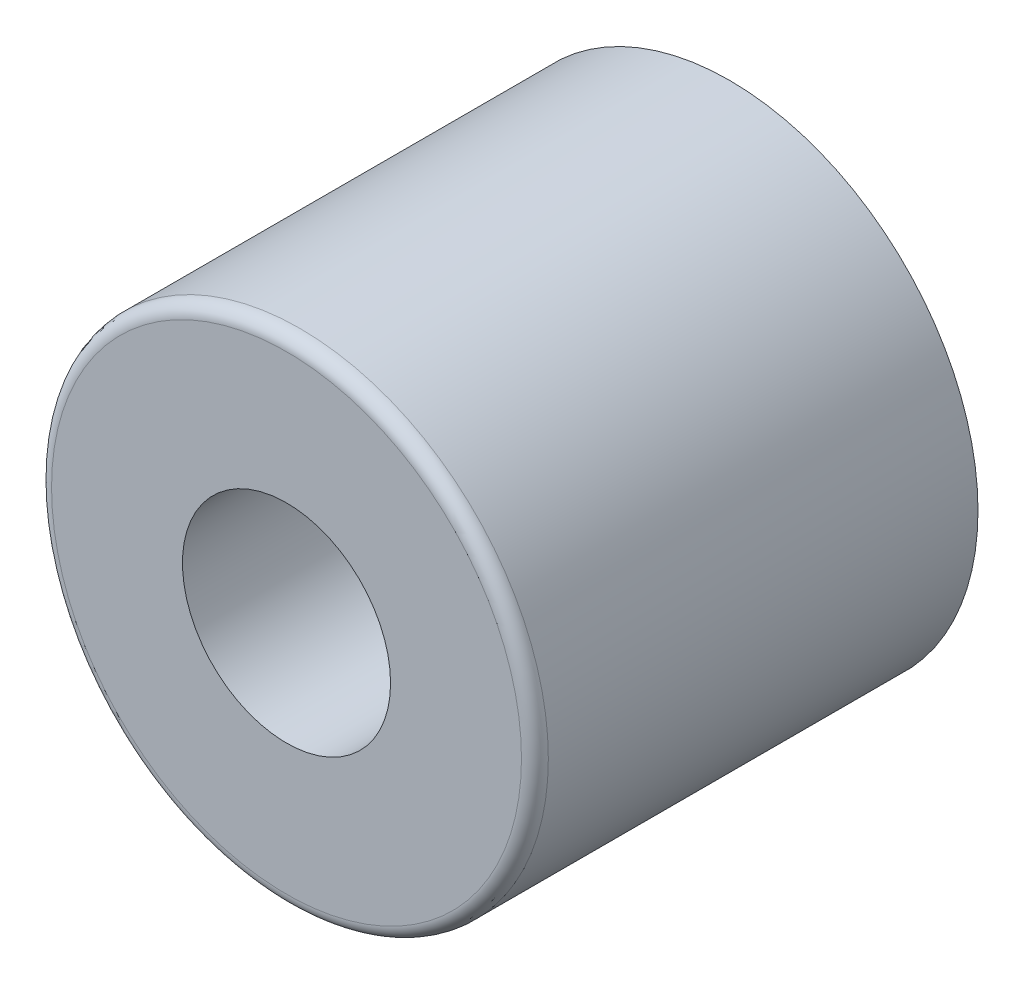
SolidWorks part; units mm, degrees
ref_plane "face" through (0, 0, 0) normal (0, 0, 1) x (1, 0, 0)
ref_plane "dessus" through (0, 0, 0) normal (0, 1, 0) x (1, 0, 0)
ref_plane "profil" through (0, 0, 0) normal (1, 0, 0) x (0, 0, -1)
sketch "Esquisse1" plane through (0, 0, 0) normal (0, 0, 1) x (1, 0, 0)
  circle A0 centre (0, 0) radius 18.5
  circle A1 centre (0, 0) radius 7.75
  dimension "D1" = 15.5
  dimension "D2" = 37
extrude "Base-Extrusion" add sketch "Esquisse1" along normal blind 33
fillet "Congé1" radius 1
